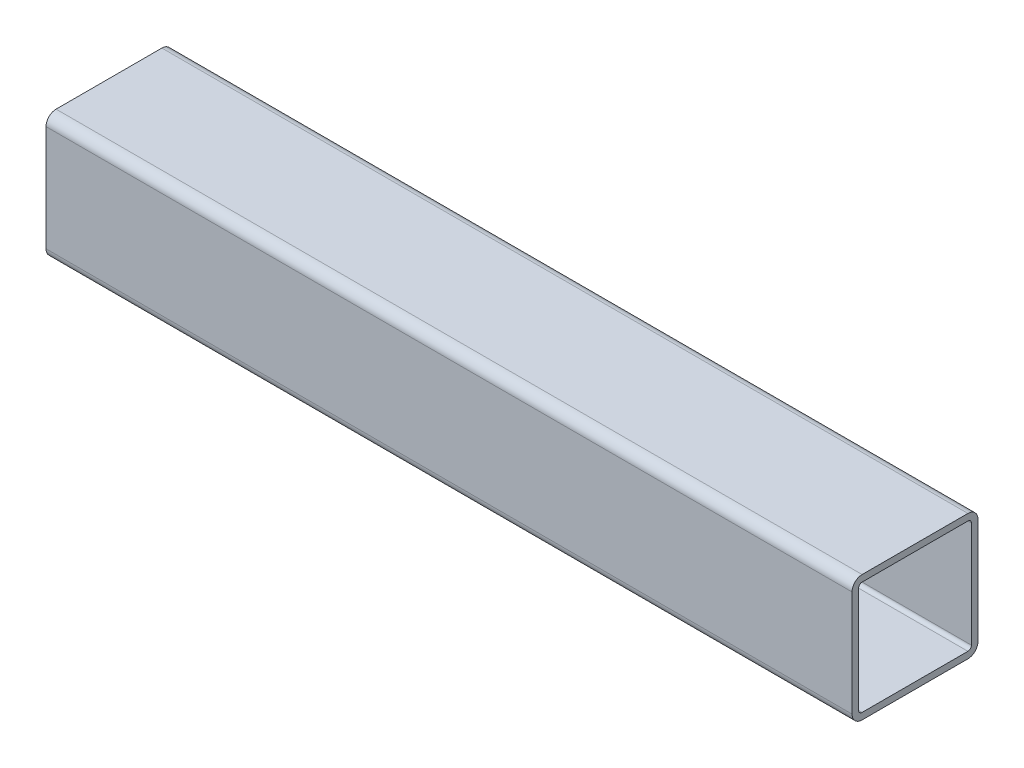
SolidWorks part; units mm, degrees
ref_plane "Front Plane" through (0, 0, 0) normal (0, 0, 1) x (1, 0, 0)
ref_plane "Top Plane" through (0, 0, 0) normal (0, 1, 0) x (1, 0, 0)
ref_plane "Right Plane" through (0, 0, 0) normal (1, 0, 0) x (0, 0, -1)
sketch "Sketch1" plane through (0, 0, 0) normal (1, 0, 0) x (0, 0, -1)
  line L0 (0, 2.54) -> (0, 29.21)
  line L1 (-2.54, 31.75) -> (-29.21, 31.75)
  line L2 (-31.75, 29.21) -> (-31.75, 2.54)
  line L3 (-29.21, 0) -> (-2.54, 0)
  line L4 (-1.651, 2.54) -> (-1.651, 29.21)
  line L5 (-2.54, 30.099) -> (-29.21, 30.099)
  line L6 (-30.099, 29.21) -> (-30.099, 2.54)
  line L7 (-29.21, 1.651) -> (-2.54, 1.651)
  arc A0 (-31.75, 2.54) -> (-29.21, 0) centre (-29.21, 2.54) ccw
  arc A1 (0, 2.54) -> (-2.54, 0) centre (-2.54, 2.54) cw
  arc A2 (0, 29.21) -> (-2.54, 31.75) centre (-2.54, 29.21) ccw
  arc A3 (-31.75, 29.21) -> (-29.21, 31.75) centre (-29.21, 29.21) cw
  arc A4 (-1.651, 29.21) -> (-2.54, 30.099) centre (-2.54, 29.21) ccw
  arc A5 (-30.099, 29.21) -> (-29.21, 30.099) centre (-29.21, 29.21) cw
  arc A6 (-30.099, 2.54) -> (-29.21, 1.651) centre (-29.21, 2.54) ccw
  arc A7 (-1.651, 2.54) -> (-2.54, 1.651) centre (-2.54, 2.54) cw
  point P12 (0, 0)
  point P15 (0, 31.75)
  point P18 (-31.75, 31.75)
  dimension "D3" = 2.54
  dimension "D1" = 31.75
  dimension "D2" = 31.75
  dimension "D4" = 1.651
extrude "Boss-Extrude1" add sketch "Sketch1" along normal blind 203.2
